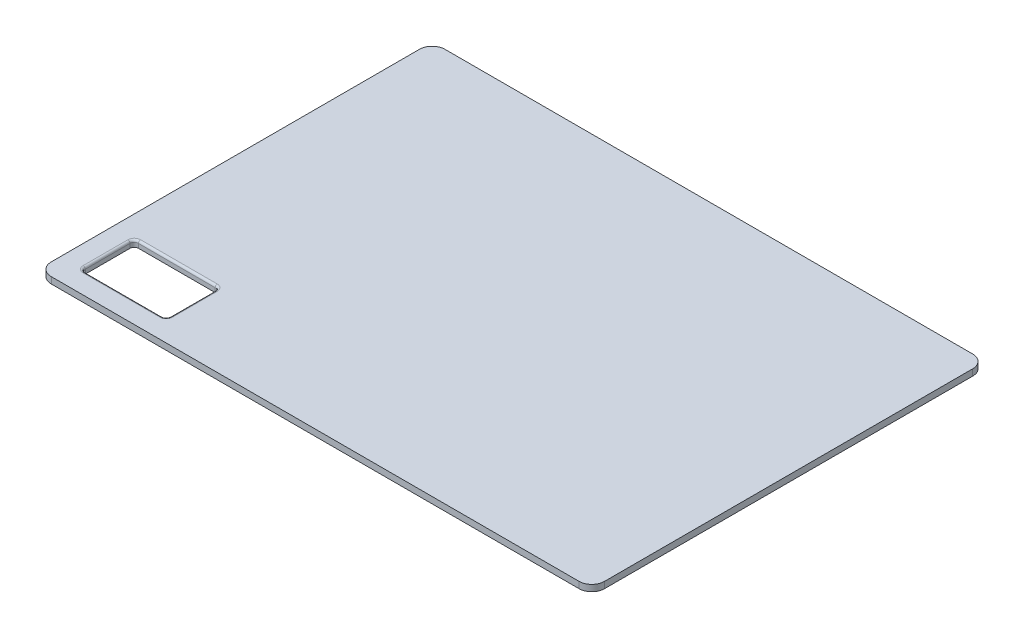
SolidWorks part; units mm, degrees
ref_plane "Front" through (0, 0, 0) normal (0, 0, 1) x (1, 0, 0)
ref_plane "Top" through (0, 0, 0) normal (0, 1, 0) x (1, 0, 0)
ref_plane "Right" through (0, 0, 0) normal (1, 0, 0) x (0, 0, -1)
sketch "Sketch1" plane through (0, 0, 0) normal (0, 1, 0) x (1, 0, 0)
  line L1 (0, 0) -> (260, 0)
  line L2 (0, 0) -> (0, 185)
  line L3 (0, 185) -> (260, 185)
  line L4 (260, 0) -> (260, 185)
  dimension "D1" = 260
  dimension "D2" = 185
extrude "Extrude1" add sketch "Sketch1" along normal blind 3
fillet "Fillet3" radius 6 4 edges at (0, 1.5, -185) (260, 1.5, -185) (260, 1.5, 0) (0, 1.5, 0)
sketch "Sketch2" plane through (0, 3, 0) normal (0, 1, 0) x (-1, 0, 0)
  line L0 (0, -179) -> (0, -6) construction
  line L1 (-10, -10) -> (-50, -10)
  line L2 (-10, -10) -> (-10, -35)
  line L3 (-10, -35) -> (-50, -35)
  line L4 (-50, -10) -> (-50, -35)
  line L5 (-6, 0) -> (-254, 0) construction
  dimension "D1" = 10
  dimension "D2" = 10
  dimension "D3" = 40
  dimension "D4" = 25
extrude "Cut-Extrude1" cut sketch "Sketch2" against normal through all
fillet "Fillet1" radius 2 4 edges at (50, 1.5, -35) (50, 1.5, -10) (10, 1.5, -10) (10, 1.5, -35)
fillet "Fillet2" radius 1 8 edges at (10.5858, 3, -10.5858) (10, 3, -22.5) (10.5858, 3, -34.4142) (30, 3, -35) (49.4142, 3, -34.4142) (50, 3, -22.5) (49.4142, 3, -10.5858) (30, 3, -10)
